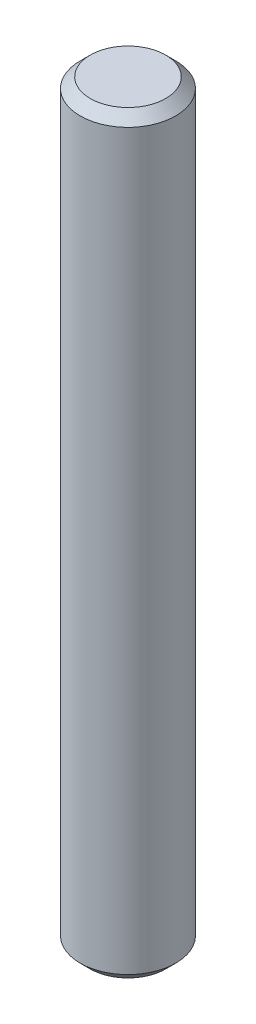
SolidWorks part; units mm, degrees
ref_plane "前视基准面" through (0, 0, 0) normal (0, 0, 1) x (1, 0, 0)
ref_plane "上视基准面" through (0, 0, 0) normal (0, 1, 0) x (1, 0, 0)
ref_plane "右视基准面" through (0, 0, 0) normal (1, 0, 0) x (0, 0, -1)
other "Configuration Table"
sketch "草图1" plane through (0, 0, 0) normal (0, 1, 0) x (1, 0, 0)
  circle A0 centre (0, 0) radius 0.95
  dimension "D1" = 1.9
extrude "凸台-拉伸1" add sketch "草图1" along normal blind 15
chamfer "倒角1" distance 0.2 angle 45 2 edges at (0, 0, 0.95) (0, 15, 0.95)
